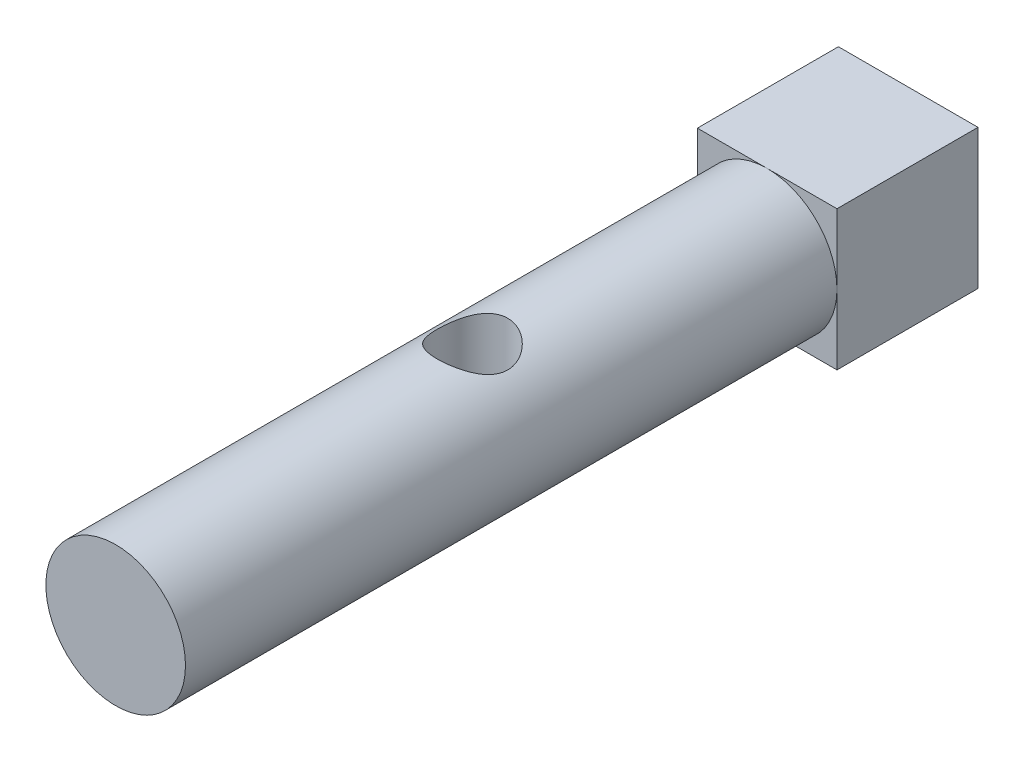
SolidWorks part; units mm, degrees
ref_plane "Front Plane" through (0, 0, 0) normal (0, 0, 1) x (1, 0, 0)
ref_plane "Top Plane" through (0, 0, 0) normal (0, 1, 0) x (1, 0, 0)
ref_plane "Right Plane" through (0, 0, 0) normal (1, 0, 0) x (0, 0, -1)
sketch "Sketch1" plane through (0, 0, 0) normal (0, 0, 1) x (1, 0, 0)
  circle A0 centre (0, 0) radius 4.95
  dimension "D1" = 9.9
extrude "Boss-Extrude1" add sketch "Sketch1" along normal blind 46.2
sketch "Sketch2" plane through (0, 0, 0) normal (0, 0, -1) x (-1, 0, 0)
  line L0 (0, 4.95) -> (0, -4.95) construction
  line L1 (-4.95, 0) -> (4.95, 0) construction
  line L2 (4.95, 4.95) -> (-4.95, 4.95)
  line L3 (4.95, 4.95) -> (4.95, -4.95)
  line L4 (-4.95, 4.95) -> (-4.95, -4.95)
  line L5 (4.95, -4.95) -> (-4.95, -4.95)
  line L6 (4.95, 4.95) -> (-4.95, -4.95) construction
  line L7 (-4.95, 4.95) -> (4.95, -4.95) construction
  circle A0 centre (0, 0) radius 4.95 construction
  point P7 (0, -4.95)
  point P8 (0, 0)
  dimension "D1" = 9.9
extrude "Boss-Extrude2" add sketch "Sketch2" along normal blind 10
sketch "Sketch3" plane through (0, 0, 0) normal (0, 1, 0) x (1, 0, 0)
  line L0 (0, -46.2) -> (0, -20.9) construction
  line L1 (-4.95, -46.2) -> (4.95, -46.2) construction
  circle A0 centre (0, -20.9) radius 2.5
  dimension "D2" = 5
  dimension "D1" = 25.3
extrude "Cut-Extrude1" cut sketch "Sketch3" against normal through all and the other way up to next
